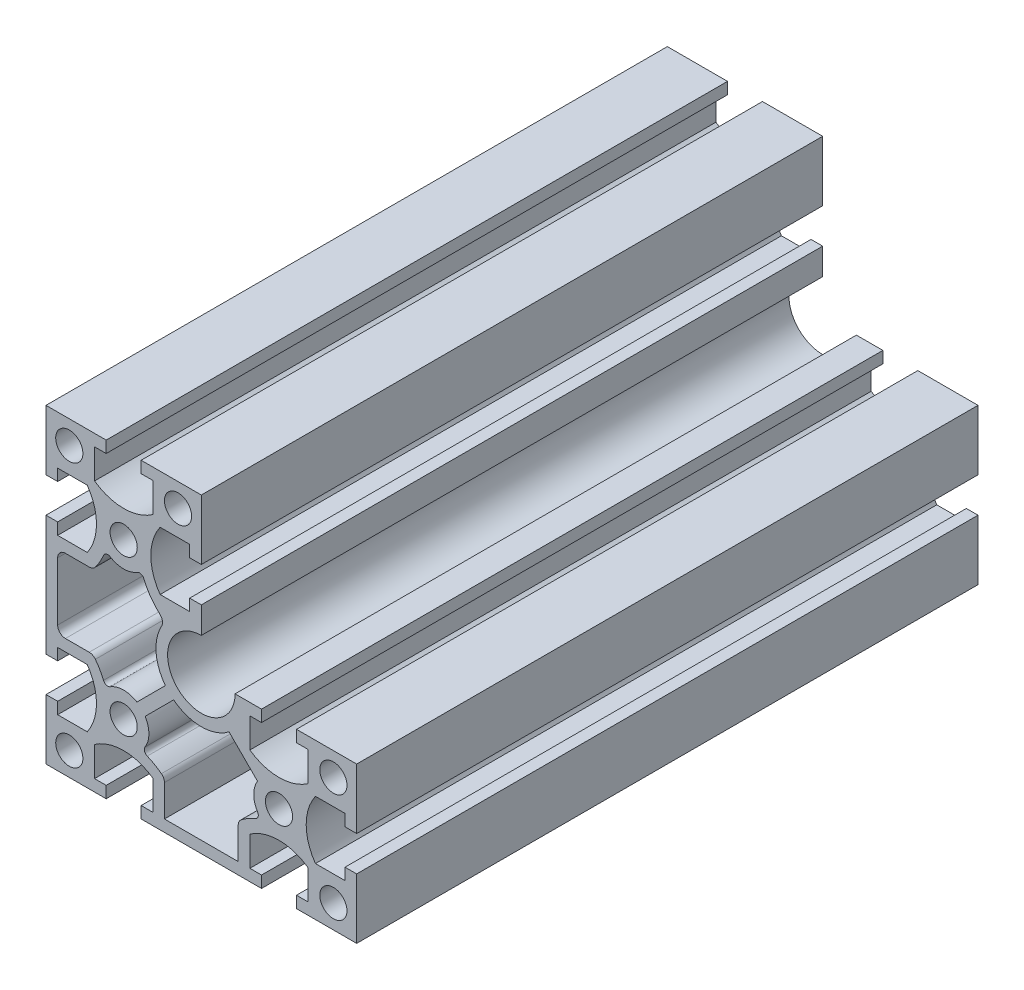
SolidWorks part; units mm, degrees
ref_plane "前基準面" through (0, 0, 0) normal (0, 0, 1) x (1, 0, 0)
ref_plane "上基準面" through (0, 0, 0) normal (0, 1, 0) x (1, 0, 0)
ref_plane "右基準面" through (0, 0, 0) normal (1, 0, 0) x (0, 0, -1)
sketch "草圖1" plane through (0, 0, 0) normal (0, 0, 1) x (1, 0, 0)
  line L0 (0, 25) -> (0, 4.3437) construction
  line L1 (0, 0) -> (25, 0) construction
  line L2 (0, 20) -> (-7.75, 20)
  line L3 (-7.75, 20) -> (-7.75, 18.5)
  line L4 (-7.75, 18.5) -> (-6.25, 18.5)
  line L5 (-6.25, 18.5) -> (-6.25, 14.6908)
  line L6 (-10, 20) -> (-10, 14.0076) construction
  line L7 (-13.75, 14.6908) -> (-13.75, 18.5)
  line L8 (-13.75, 18.5) -> (-12.25, 18.5)
  line L9 (-12.25, 18.5) -> (-12.25, 20)
  line L10 (-12.25, 20) -> (-20, 20)
  line L11 (-20, 20) -> (-20, 12.25)
  line L12 (-20, 12.25) -> (-18.5, 12.25)
  line L13 (-18.5, 12.25) -> (-18.5, 13.75)
  line L14 (-18.5, 13.75) -> (-14.6908, 13.75)
  line L15 (-20.5861, 10) -> (-14.2211, 10) construction
  line L16 (-14.6908, 6.25) -> (-18.5, 6.25)
  line L17 (-18.5, 6.25) -> (-18.5, 7.75)
  line L18 (-18.5, 7.75) -> (-20, 7.75)
  line L19 (-20, 7.75) -> (-20, -7.75)
  line L20 (-18.5, -3.75) -> (-18.5, 3.75)
  line L21 (-17.5, 4.75) -> (-14.4379, 4.75)
  line L22 (0.5861, 10) -> (-5.7789, 10) construction
  line L23 (-1.5, 12.25) -> (-1.5, 13.75)
  line L24 (-1.5, 13.75) -> (-5.3092, 13.75)
  line L25 (-5.3092, 6.25) -> (-1.5, 6.25)
  line L26 (-1.5, 6.25) -> (-1.5, 7.75)
  line L27 (0, 7.75) -> (0, 4.3437)
  line L28 (-1.5, 7.75) -> (0, 7.75)
  line L29 (0, 12.25) -> (-1.5, 12.25)
  line L30 (0, 20) -> (0, 12.25)
  line L31 (-7.75, -18.5) -> (-6.25, -18.5)
  line L32 (-6.25, -18.5) -> (-6.25, -14.6908)
  line L33 (-20.5861, -10) -> (-14.2211, -10) construction
  line L34 (-10, -20) -> (-10, -14.0076) construction
  line L35 (-17.5, -4.75) -> (-14.4379, -4.75)
  line L36 (-18.5, -7.75) -> (-20, -7.75)
  line L37 (-18.5, -6.25) -> (-18.5, -7.75)
  line L38 (-14.6908, -6.25) -> (-18.5, -6.25)
  line L39 (-18.5, -13.75) -> (-14.6908, -13.75)
  line L40 (-18.5, -12.25) -> (-18.5, -13.75)
  line L41 (-20, -12.25) -> (-18.5, -12.25)
  line L42 (-20, -20) -> (-20, -12.25)
  line L43 (-12.25, -20) -> (-20, -20)
  line L44 (-12.25, -18.5) -> (-12.25, -20)
  line L45 (-13.75, -18.5) -> (-12.25, -18.5)
  line L46 (-13.75, -14.6908) -> (-13.75, -18.5)
  line L47 (-7.75, -20) -> (-7.75, -18.5)
  line L48 (-4.75, -18.5) -> (-4.75, -14.4379)
  line L49 (-7.75, -20) -> (7.75, -20)
  line L50 (-4.75, -18.5) -> (4.75, -18.5)
  line L51 (0, 0) -> (-10, -10) construction
  line L52 (-4.75, -18.5) -> (-4.75, -14.6908) construction
  line L53 (3.5676, -4.6283) -> (7.2336, -8.2943)
  line L54 (4.75, -18.5) -> (4.75, -14.4379)
  line L55 (10, -20) -> (10, -14.0076) construction
  line L56 (-4.6283, -3.5676) -> (-8.2943, -7.2336)
  line L57 (-3.5676, -4.6283) -> (-7.2336, -8.2943)
  line L58 (20.5861, -10) -> (14.2211, -10) construction
  line L59 (7.75, -20) -> (7.75, -18.5)
  line L60 (13.75, -14.6908) -> (13.75, -18.5)
  line L61 (13.75, -18.5) -> (12.25, -18.5)
  line L62 (12.25, -18.5) -> (12.25, -20)
  line L63 (12.25, -20) -> (20, -20)
  line L64 (20, -20) -> (20, -12.25)
  line L65 (20, -12.25) -> (18.5, -12.25)
  line L66 (18.5, -12.25) -> (18.5, -13.75)
  line L67 (18.5, -13.75) -> (14.6908, -13.75)
  line L68 (14.6908, -6.25) -> (18.5, -6.25)
  line L69 (18.5, -6.25) -> (18.5, -7.75)
  line L70 (18.5, -7.75) -> (20, -7.75)
  line L71 (12.25, 0) -> (20, 0)
  line L72 (6.25, -18.5) -> (6.25, -14.6908)
  line L73 (7.75, -18.5) -> (6.25, -18.5)
  line L74 (10, 0) -> (10, -5.9924) construction
  line L75 (7.75, 0) -> (7.75, -1.5)
  line L76 (12.25, -1.5) -> (12.25, 0)
  line L77 (7.75, -1.5) -> (6.25, -1.5)
  line L78 (6.25, -1.5) -> (6.25, -5.3092)
  line L79 (13.75, -1.5) -> (12.25, -1.5)
  line L80 (13.75, -5.3092) -> (13.75, -1.5)
  line L81 (20, -7.75) -> (20, 0)
  line L82 (7.75, 0) -> (4.3437, 0)
  arc A0 (-14.6908, 13.75) -> (-14.6908, 6.25) centre (-20, 10) cw
  arc A1 (-13.75, 14.6908) -> (-6.25, 14.6908) centre (-10, 20) ccw
  arc A2 (0, 4.3437) -> (4.3437, 0) centre (0, 0) ccw
  arc A3 (-5.1233, 2.8108) -> (-4.6283, -3.5676) centre (0, 0) ccw
  circle A4 centre (-10, 10) radius 1.75
  arc A5 (-11.7247, 7.2454) -> (-8.2753, 7.2454) centre (-10, 10) ccw
  arc A6 (-5.3092, 13.75) -> (-5.3092, 6.25) centre (0, 10) ccw
  arc A7 (-7.4017, 6.9645) -> (-5.3333, 4.0372) centre (0, 10) ccw
  arc A8 (-18.5, 3.75) -> (-17.5, 4.75) centre (-17.5, 3.75) cw
  arc A9 (-14.4379, 4.75) -> (-13.6433, 5.1429) centre (-14.4379, 5.75) ccw
  circle A10 centre (-17, 17) radius 1.75
  arc A11 (-5.1233, 2.8108) -> (-5.3333, 4.0372) centre (-6, 3.2918) ccw
  circle A12 centre (-10, 10) radius 3.25 construction
  circle A13 centre (-3, 17) radius 1.75
  arc A14 (-7.4017, 6.9645) -> (-8.2753, 7.2454) centre (-7.9569, 6.7369) ccw
  arc A15 (-12.5983, 6.9645) -> (-13.6433, 5.1429) centre (-20, 10) cw
  arc A16 (-11.7247, 7.2454) -> (-12.5983, 6.9645) centre (-12.0431, 6.7369) ccw
  arc A17 (-13.75, -14.6908) -> (-6.25, -14.6908) centre (-10, -20) cw
  arc A18 (-11.7247, -7.2454) -> (-12.5983, -6.9645) centre (-12.0431, -6.7369) cw
  arc A19 (-12.5983, -6.9645) -> (-13.6433, -5.1429) centre (-20, -10) ccw
  arc A20 (-3.5676, -4.6283) -> (3.5676, -4.6283) centre (0, 0) ccw
  circle A21 centre (-17, -17) radius 1.75
  arc A22 (-14.4379, -4.75) -> (-13.6433, -5.1429) centre (-14.4379, -5.75) cw
  arc A23 (-18.5, -3.75) -> (-17.5, -4.75) centre (-17.5, -3.75) ccw
  arc A24 (-11.7247, -7.2454) -> (-8.2943, -7.2336) centre (-10, -10) cw
  circle A25 centre (-10, -10) radius 1.75
  arc A26 (-14.6908, -13.75) -> (-14.6908, -6.25) centre (-20, -10) ccw
  arc A27 (-4.75, -14.4379) -> (-5.1429, -13.6433) centre (-5.75, -14.4379) ccw
  arc A28 (6.9645, -12.5983) -> (5.1429, -13.6433) centre (10, -20) ccw
  arc A29 (-7.2336, -8.2943) -> (-7.2454, -11.7247) centre (-10, -10) cw
  arc A30 (4.75, -14.4379) -> (5.1429, -13.6433) centre (5.75, -14.4379) cw
  arc A31 (-6.9645, -12.5983) -> (-5.1429, -13.6433) centre (-10, -20) cw
  arc A32 (-14.6154, -13.4656) -> (-5.3846, -13.4656) centre (-10, -20) cw construction
  arc A33 (-6.9645, -12.5983) -> (-7.2454, -11.7247) centre (-6.7369, -12.0431) cw
  arc A34 (6.9645, -12.5983) -> (7.2454, -11.7247) centre (6.7369, -12.0431) ccw
  arc A35 (7.2336, -8.2943) -> (7.2454, -11.7247) centre (10, -10) ccw
  arc A36 (14.6908, -13.75) -> (14.6908, -6.25) centre (20, -10) cw
  circle A37 centre (10, -10) radius 1.75
  circle A38 centre (17, -3) radius 1.75
  arc A39 (13.75, -5.3092) -> (6.25, -5.3092) centre (10, 0) cw
  circle A41 centre (17, -17) radius 1.75
  arc A44 (13.75, -14.6908) -> (6.25, -14.6908) centre (10, -20) ccw
  point P66 (-7.6719, 7.7323)
  point P69 (-12.3281, 7.7323)
  point P98 (-18.5, 0)
  point P99 (-20, 0)
  point P109 (-12.3281, -7.7323)
  point P132 (0, -18.5)
  point P133 (0, -20)
  dimension "D6" = 6.5
  dimension "D12" = 6.5
  dimension "D14" = 1.5
  dimension "D15" = 3.5
  dimension "D19" = 3
  dimension "D20" = 3
  dimension "D17" = 1
  dimension "D18" = 1
  dimension "D21" = 0.6
  dimension "D23" = 1.5
  dimension "D24" = 1.5
  dimension "D28" = 0.6
  dimension "D31" = 1
  dimension "D1" = 25
  dimension "D2" = 20
  dimension "D3" = 20
  dimension "D4" = 4.5
  dimension "D5" = 7.5
  dimension "D7" = 0
  dimension "D8" = 1.5
  dimension "D9" = 4.5
  dimension "D10" = 10
  dimension "D11" = 7.5
  dimension "D13" = 0
  dimension "D22" = 1.5
  dimension "D25" = 1.5
  dimension "D29" = 0.75
  dimension "D30" = 6
  dimension "D16" = 1.5
  dimension "D26" = 1.5
  dimension "D27" = 1.5
extrude "填料-伸長1" add sketch "草圖1" along normal mid plane 80
